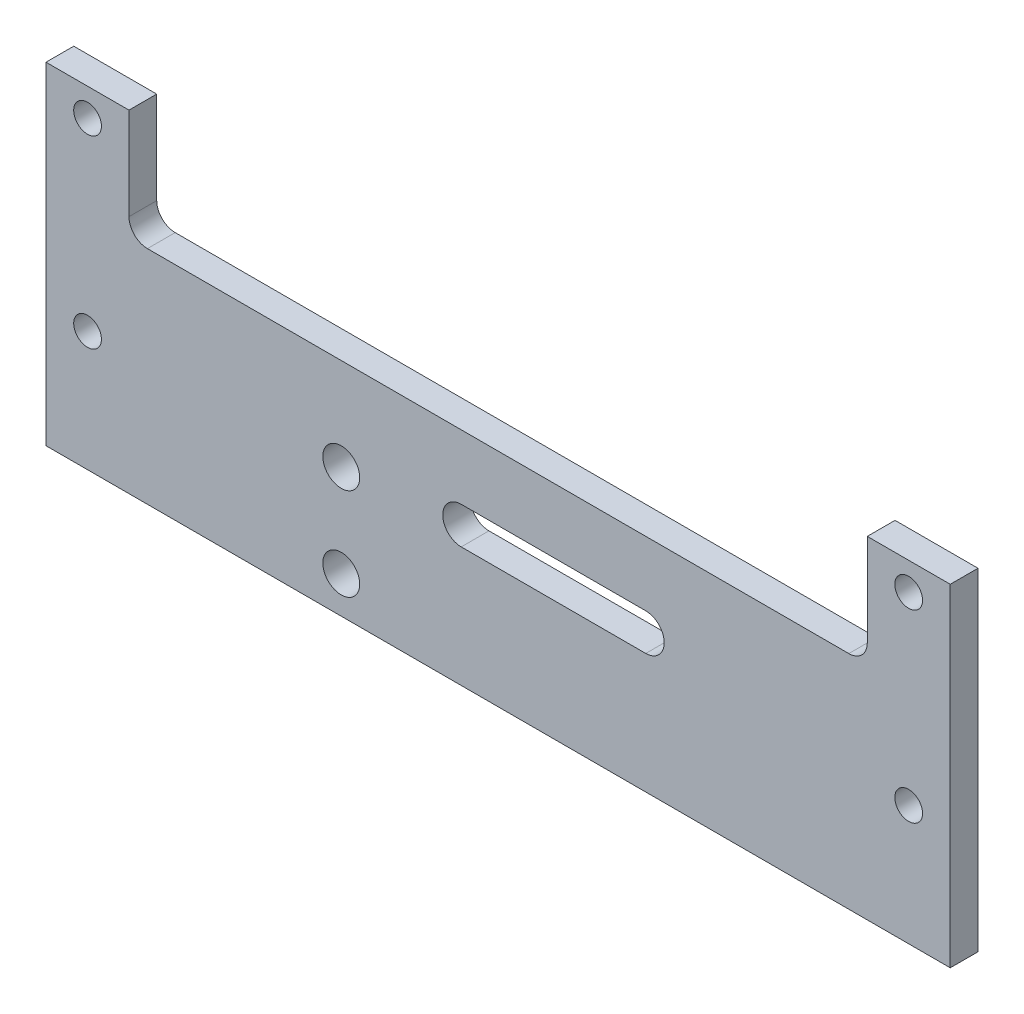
SolidWorks part; units mm, degrees
ref_plane "Front Plane" through (0, 0, 0) normal (0, 0, 1) x (1, 0, 0)
ref_plane "Top Plane" through (0, 0, 0) normal (0, 1, 0) x (1, 0, 0)
ref_plane "Right Plane" through (0, 0, 0) normal (1, 0, 0) x (0, 0, -1)
sketch "Sketch1" plane through (0, 0, 0) normal (0, 0, 1) x (1, 0, 0)
  line L0 (0, 0) -> (0, 38.5974) construction
  line L1 (0, 0) -> (77.7875, 0)
  line L2 (77.7875, 0) -> (77.7875, 57.15)
  line L3 (77.7875, 57.15) -> (63.5127, 57.15)
  line L4 (63.5127, 57.15) -> (63.5127, 38.1)
  line L5 (63.5127, 38.1) -> (-63.5127, 38.1)
  line L6 (-63.5127, 38.1) -> (-63.5127, 57.15)
  line L7 (-63.5127, 57.15) -> (-77.7875, 57.15)
  line L8 (-77.7875, 57.15) -> (-77.7875, 0)
  line L9 (-77.7875, 0) -> (0, 0)
  line L10 (-6.35, 23.8252) -> (25.4, 23.8252) construction
  line L11 (-6.35, 27.0002) -> (25.4, 27.0002)
  line L12 (-6.35, 20.6502) -> (25.4, 20.6502)
  circle A0 centre (-70.6374, 20.6248) radius 2.3876
  circle A1 centre (-70.6374, 52.3748) radius 2.3876
  circle A2 centre (70.6374, 52.3748) radius 2.3876
  circle A3 centre (70.6374, 20.6248) radius 2.3876
  circle A4 centre (-70.6374, 52.3748) radius 3.9624
  arc A6 (-6.35, 27.0002) -> (-6.35, 20.6502) centre (-6.35, 23.8252) ccw
  arc A9 (25.4, 20.6502) -> (25.4, 27.0002) centre (25.4, 23.8252) ccw
  circle A12 centre (-26.9875, 6.35) radius 3.175
  circle A13 centre (-26.9875, 22.225) radius 3.175
  point P22 (9.525, 23.8252)
  dimension "D8" = 4.7752
  dimension "D9" = 2.3876
  dimension "D10" = 7.9248
  dimension "D15" = 7.1247
  dimension "D11" = 14.2748
  dimension "D21" = 6.35
  dimension "D1" = 14.2748
  dimension "D2" = 155.575
  dimension "D3" = 57.15
  dimension "D4" = 19.05
  dimension "D5" = 141.2748
  dimension "D6" = 4.7752
  dimension "D7" = 31.75
  dimension "D12" = 6.35
  dimension "D13" = 6.35
  dimension "D14" = 31.75
  dimension "D16" = 7.1501
  dimension "D17" = 38.1
  dimension "D22" = 50.8
  dimension "D23" = 15.875
  dimension "D24" = 6.35
sketch "Sketch2" plane through (0, 0, 0) normal (0, 0, 1) x (1, 0, 0)
  line L0 (-77.7875, 0) -> (0, 0) construction
  line L1 (0, 0) -> (77.7875, 0) construction
  line L2 (77.7875, 0) -> (77.7875, 57.15) construction
  line L3 (77.7875, 57.15) -> (63.5127, 57.15) construction
  line L4 (63.5127, 57.15) -> (63.5127, 38.1) construction
  line L5 (63.5127, 38.1) -> (-63.5127, 38.1) construction
  line L6 (-63.5127, 38.1) -> (-63.5127, 57.15) construction
  line L7 (-63.5127, 57.15) -> (-77.7875, 57.15) construction
  line L8 (-77.7875, 57.15) -> (-77.7875, 0) construction
  line L9 (-77.7875, 0) -> (0, 0)
  line L10 (0, 0) -> (77.7875, 0)
  line L11 (77.7875, 0) -> (77.7875, 57.15)
  line L12 (77.7875, 57.15) -> (63.5127, 57.15)
  line L13 (63.5127, 57.15) -> (63.5127, 38.1)
  line L14 (63.5127, 38.1) -> (-63.5127, 38.1)
  line L15 (-63.5127, 38.1) -> (-63.5127, 57.15)
  line L16 (-63.5127, 57.15) -> (-77.7875, 57.15)
  line L17 (-77.7875, 57.15) -> (-77.7875, 0)
  line L19 (-6.35, 20.6502) -> (25.4, 20.6502) construction
  line L20 (-6.35, 27.0002) -> (25.4, 27.0002) construction
  line L21 (-6.35, 20.6502) -> (25.4, 20.6502)
  line L22 (-6.35, 27.0002) -> (25.4, 27.0002)
  circle A0 centre (-70.6374, 20.6248) radius 2.3876 construction
  circle A1 centre (-70.6374, 52.3748) radius 2.3876 construction
  circle A2 centre (70.6374, 20.6248) radius 2.3876 construction
  circle A3 centre (70.6374, 52.3748) radius 2.3876 construction
  circle A4 centre (-70.6374, 20.6248) radius 2.3876
  circle A5 centre (-70.6374, 52.3748) radius 2.3876
  circle A6 centre (70.6374, 20.6248) radius 2.3876
  circle A7 centre (70.6374, 52.3748) radius 2.3876
  arc A11 (25.4, 20.6502) -> (25.4, 27.0002) centre (25.4, 23.8252) ccw construction
  arc A12 (-6.35, 27.0002) -> (-6.35, 20.6502) centre (-6.35, 23.8252) ccw construction
  arc A13 (25.4, 20.6502) -> (25.4, 27.0002) centre (25.4, 23.8252) ccw
  arc A14 (-6.35, 27.0002) -> (-6.35, 20.6502) centre (-6.35, 23.8252) ccw
  circle A16 centre (-26.9875, 6.35) radius 3.175 construction
  circle A17 centre (-26.9875, 22.225) radius 3.175 construction
  circle A18 centre (-26.9875, 6.35) radius 3.175
  circle A19 centre (-26.9875, 22.225) radius 3.175
extrude "Boss-Extrude1" add sketch "Sketch2" along normal blind 4.7752
fillet "Fillet1" radius 3.175 2 edges at (63.5127, 38.1, 2.3876) (-63.5127, 38.1, 2.3876)
